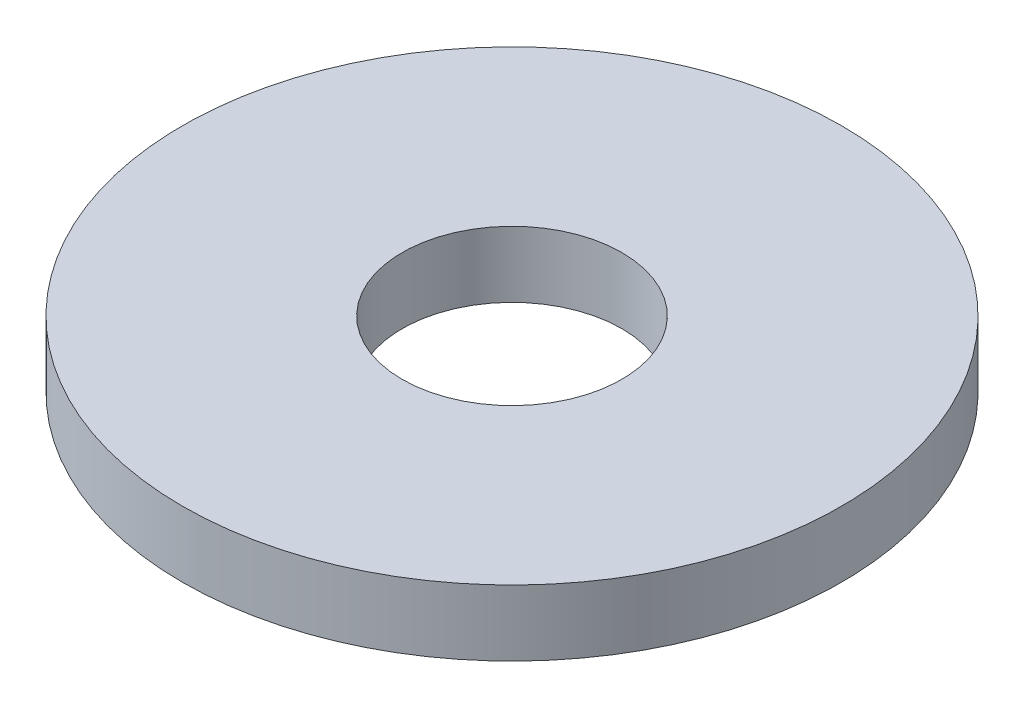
SolidWorks part; units mm, degrees
ref_plane "Front" through (0, 0, 0) normal (0, 0, 1) x (1, 0, 0)
ref_plane "Top" through (0, 0, 0) normal (0, 1, 0) x (1, 0, 0)
ref_plane "Right" through (0, 0, 0) normal (1, 0, 0) x (0, 0, -1)
sketch "Sketch1" plane through (0, 0, 0) normal (0, 1, 0) x (1, 0, 0)
  circle A0 centre (0, 0) radius 15
  circle A1 centre (0, 0) radius 5
extrude "Extrude1" add sketch "Sketch1" along normal blind 3
